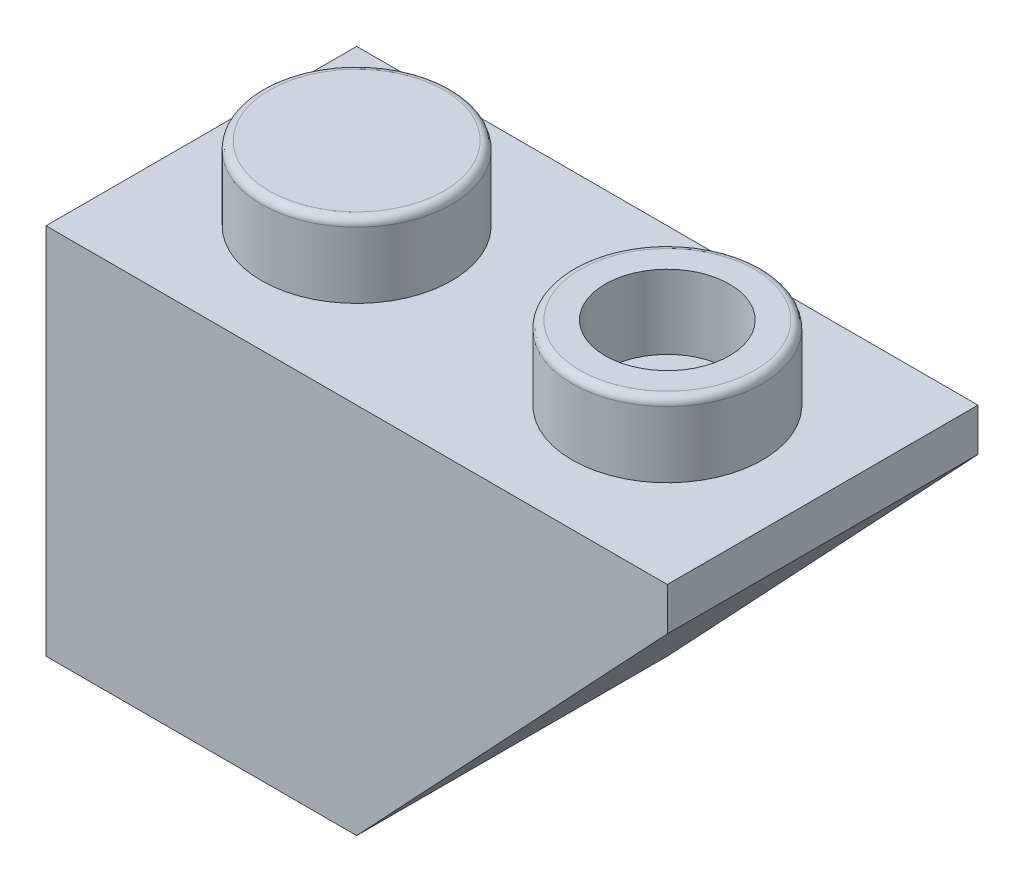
SolidWorks part; units mm, degrees
ref_plane "Vorne" through (0, 0, 0) normal (0, 0, 1) x (1, 0, 0)
ref_plane "Oben" through (0, 0, 0) normal (0, 1, 0) x (1, 0, 0)
ref_plane "Rechts" through (0, 0, 0) normal (1, 0, 0) x (0, 0, -1)
sketch "Skizze1" plane through (0, 0, 0) normal (0, 0, 1) x (1, 0, 0)
  line L1 (0, 0) -> (16, 0)
  line L2 (0, 0) -> (0, 9.6)
  line L3 (0, 9.6) -> (16, 9.6)
  line L4 (16, 0) -> (16, 9.6)
  dimension "D1" = 16
  dimension "D2" = 9.6
extrude "Linear austragen1" add sketch "Skizze1" along normal blind 8
sketch "Skizze2" plane through (0, 0, 8) normal (0, 0, 1) x (1, 0, 0)
  line L0 (16, 8.5) -> (8, 0)
  line L1 (16, 0) -> (16, 9.6) construction
  line L2 (0, 0) -> (16, 0) construction
  line L3 (8, 0) -> (16, 0)
  line L4 (16, 0) -> (16, 8.5)
  line L5 (16, 9.6) -> (0, 9.6) construction
  dimension "D1" = 8
  dimension "D2" = 1.1
extrude "Schnitt-Linear austragen1" cut sketch "Skizze2" against normal blind 8
sketch "Skizze3" plane through (0, 0, 0) normal (0, -1, 0) x (1, 0, 0)
  line L0 (0, 8) -> (8, 8) construction
  line L1 (0.6, 7.4) -> (7.4, 7.4)
  line L2 (0.6, 7.4) -> (0.6, 0.6)
  line L3 (0.6, 0.6) -> (7.4, 0.6)
  line L4 (7.4, 7.4) -> (7.4, 0.6)
  line L5 (0, 0) -> (8, 0) construction
  line L6 (0, 8) -> (0, 0) construction
  line L7 (8, 0) -> (8, 8) construction
  dimension "D1" = 0.6
  dimension "D2" = 0.6
  dimension "D3" = 0.6
  dimension "D4" = 0.6
extrude "Schnitt-Linear austragen2" cut sketch "Skizze3" against normal blind 8.6
sketch "Skizze4" plane through (0, 9.6, 0) normal (0, 1, 0) x (-1, 0, 0)
  line L0 (0, 8) -> (0, 0) construction
  line L1 (-16, 8) -> (-16, 0) construction
  line L2 (-16, 8) -> (0, 8) construction
  circle A0 centre (-12, 4) radius 2.45
  circle A1 centre (-4, 4) radius 2.45
  dimension "D1" = 4
  dimension "D4" = 4.9
  dimension "D6" = 4.9
  dimension "D2" = 4
  dimension "D3" = 4
  dimension "D5" = 4
extrude "Linear austragen2" add sketch "Skizze4" along normal blind 1.9
fillet "Verrundung1" radius 0.2 2 edges at (12, 11.5, 6.45) (4, 11.5, 6.45)
sketch "Skizze5" plane through (0, 8.6, 0) normal (0, -1, 0) x (1, 0, 0)
  circle A0 centre (4, 4) radius 1.25
extrude "Schnitt-Linear austragen3" cut sketch "Skizze5" against normal blind 1.8
sketch "Skizze6" plane through (0, 11.5, 0) normal (0, 1, 0) x (-1, 0, 0)
  circle A0 centre (-12, 4) radius 1.6
extrude "Schnitt-Linear austragen4" cut sketch "Skizze6" against normal blind 1.9
sketch "Skizze7" plane through (0, 8.6, 0) normal (0, -1, 0) x (1, 0, 0)
  line L0 (5.25, 4) -> (9.3933, 4) construction
  line L1 (7.4, 0.6) -> (7.4, 7.4) construction
  line L2 (7.4, 4.5) -> (6.9, 4.5)
  line L3 (7.4, 4.5) -> (7.4, 3.5)
  line L4 (7.4, 3.5) -> (6.9, 3.5)
  line L5 (6.9, 4.5) -> (6.9, 3.5)
  circle A0 centre (4, 4) radius 1.25 construction
  dimension "D1" = 1
  dimension "D2" = 0.5
  dimension "D3" = 0.5
extrude "Linear austragen3" add sketch "Skizze7" along normal blind 8.2
